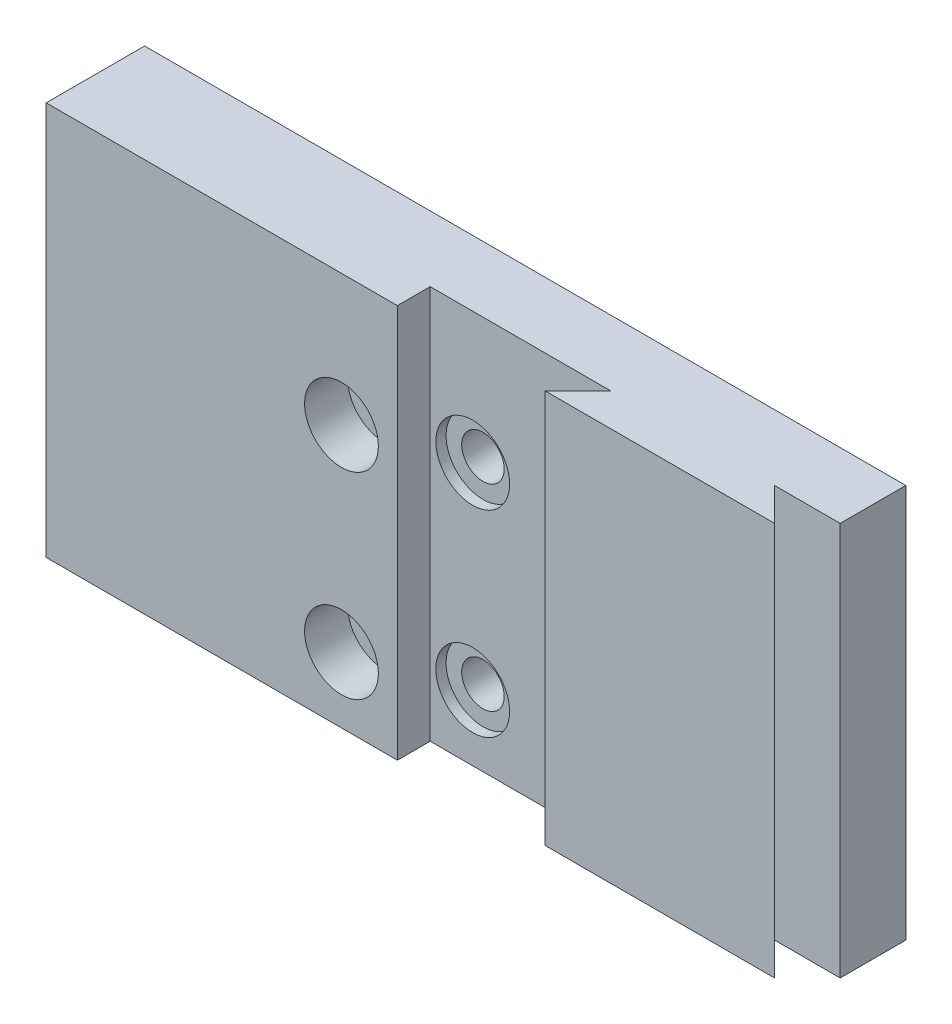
SolidWorks part; units mm, degrees
ref_plane "Front Plane" through (0, 0, 0) normal (0, 0, 1) x (1, 0, 0)
ref_plane "Top Plane" through (0, 0, 0) normal (0, 1, 0) x (1, 0, 0)
ref_plane "Right Plane" through (0, 0, 0) normal (1, 0, 0) x (0, 0, -1)
sketch "Sketch1" plane through (0, 0, 0) normal (0, 0, 1) x (1, 0, 0)
  line L0 (0, 0) -> (73.66, 0)
  line L1 (73.66, 0) -> (73.66, 38.1)
  line L2 (73.66, 38.1) -> (0, 38.1)
  line L3 (0, 38.1) -> (0, 0)
  dimension "D1" = 73.66
  dimension "D2" = 38.1
extrude "Boss-Extrude1" add sketch "Sketch1" along normal blind 9.525
sketch "Sketch2" plane through (0, 0, 0) normal (-1, 0, 0) x (0, 0, 1)
  circle A0 centre (4.7498, 6.35) radius 2.0574
  circle A1 centre (4.7498, 25.4) radius 2.0574
  dimension "D4" = 4.1148
  dimension "D1" = 4.7498
  dimension "D2" = 6.35
  dimension "D3" = 19.05
extrude "Cut-Extrude1" cut sketch "Sketch2" against normal blind 15.24
sketch "Sketch3" plane through (0, 0, 0) normal (0, -1, 0) x (1, 0, 0)
  line L0 (73.66, 6.35) -> (67.31, 6.35)
  line L1 (73.66, 9.525) -> (73.66, 0) construction
  line L2 (67.31, 6.35) -> (70.485, 9.525)
  line L3 (0, 9.525) -> (73.66, 9.525) construction
  line L4 (70.485, 9.525) -> (48.26, 9.525)
  line L5 (48.26, 9.525) -> (51.435, 6.35)
  line L6 (51.435, 6.35) -> (33.9852, 6.35)
  line L7 (33.9852, 6.35) -> (33.9852, 9.525)
  line L8 (73.66, 6.35) -> (73.66, 9.525)
  line L9 (73.66, 9.525) -> (73.66, 11.43)
  line L10 (73.66, 11.43) -> (33.9852, 11.43)
  line L11 (33.9852, 11.43) -> (33.9852, 9.525)
  line L12 (0, 0) -> (73.66, 0) construction
  dimension "D1" = 6.35
  dimension "D2" = 45
  dimension "D3" = 45
  dimension "D4" = 5.08
  dimension "D5" = 39.6748
  dimension "D6" = 15.875
  dimension "D7" = 3.175
extrude "Cut-Extrude2" cut sketch "Sketch3" against normal blind 45.72
sketch "Sketch4" plane through (0, 0, 0) normal (0, 0, 1) x (1, 0, 0)
  circle A0 centre (28.575, 25.4) radius 2.0574
  circle A1 centre (28.575, 6.35) radius 2.0574
  circle A2 centre (38.1, 6.35) radius 2.0574
  circle A3 centre (38.1, 25.4) radius 2.0574
  dimension "D4" = 4.1148
  dimension "D1" = 28.575
  dimension "D2" = 6.35
  dimension "D3" = 19.05
  dimension "D5" = 9.525
hole_wizard "CBORE for #8 Socket Head Cap Screw1" positions "Sketch6" profile "Sketch5" counterbore size "#8" standard "ANSI Inch"
sketch "Sketch6" plane through (0, 0, 9.525) normal (0, 0, 1) x (1, 0, 0)
  point P0 (28.575, 25.4)
  point P3 (28.575, 6.35)
  point P7 (38.1, 25.4)
  point P10 (38.1, 6.35)
sketch "Sketch5" plane through (28.575, 25.4, 9.525) normal (1, 0, 0) x (0, -1, 0)
  line L0 (0, 0) -> (0, 9.525)
  line L1 (0, 9.525) -> (2.0574, 9.525)
  line L3 (2.0574, 9.525) -> (2.0574, 4.1656)
  line L4 (2.0574, 4.1656) -> (3.5687, 4.1656)
  line L5 (3.5687, 4.1656) -> (3.5687, 0)
  line L7 (3.5687, 0) -> (0, 0)
  line L11 (0, -6.35) -> (0, 107.95) construction
  dimension "Thru Hole Dia." = 4.1148
  dimension "Thru Hole Depth" = 9.525
  dimension "C'Bore Dia." = 7.1374
  dimension "C'Bore Depth" = 4.1656
